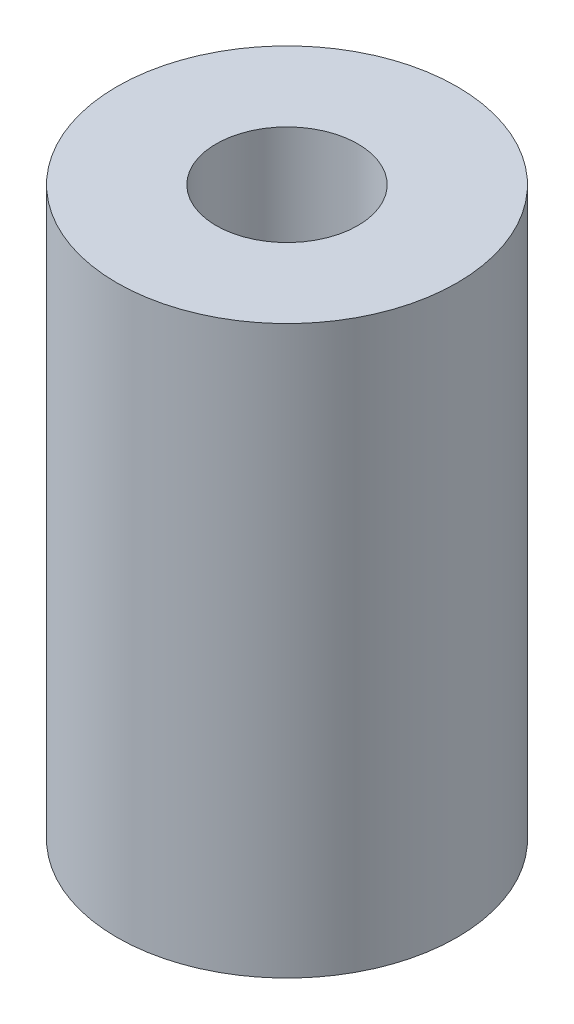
SolidWorks part; units mm, degrees
ref_plane "Front Plane" through (0, 0, 0) normal (0, 0, 1) x (1, 0, 0)
ref_plane "Top Plane" through (0, 0, 0) normal (0, 1, 0) x (1, 0, 0)
ref_plane "Right Plane" through (0, 0, 0) normal (1, 0, 0) x (0, 0, -1)
sketch "Sketch1" plane through (0, 0, 0) normal (0, 0, 1) x (1, 0, 0)
  line L0 (-161.7754, 0) -> (7926.9966, 0) construction
  line L1 (0, -161.7754) -> (0, 7926.9966) construction
  line L2 (3.175, 19.05) -> (3.175, 0)
  line L3 (3.175, 0) -> (4.826, 0)
  line L4 (4.826, 0) -> (4.826, -6.35)
  line L5 (4.826, -6.35) -> (7.62, -6.35)
  line L6 (7.62, -6.35) -> (7.62, 19.05)
  line L7 (7.62, 19.05) -> (3.175, 19.05)
  dimension "D1" = 15.24
  dimension "D2" = 25.4
  dimension "D3" = 9.652
  dimension "D4" = 6.35
  dimension "D5" = 6.35
revolve "Revolve1" add sketch "Sketch1" angle 360 about L1
